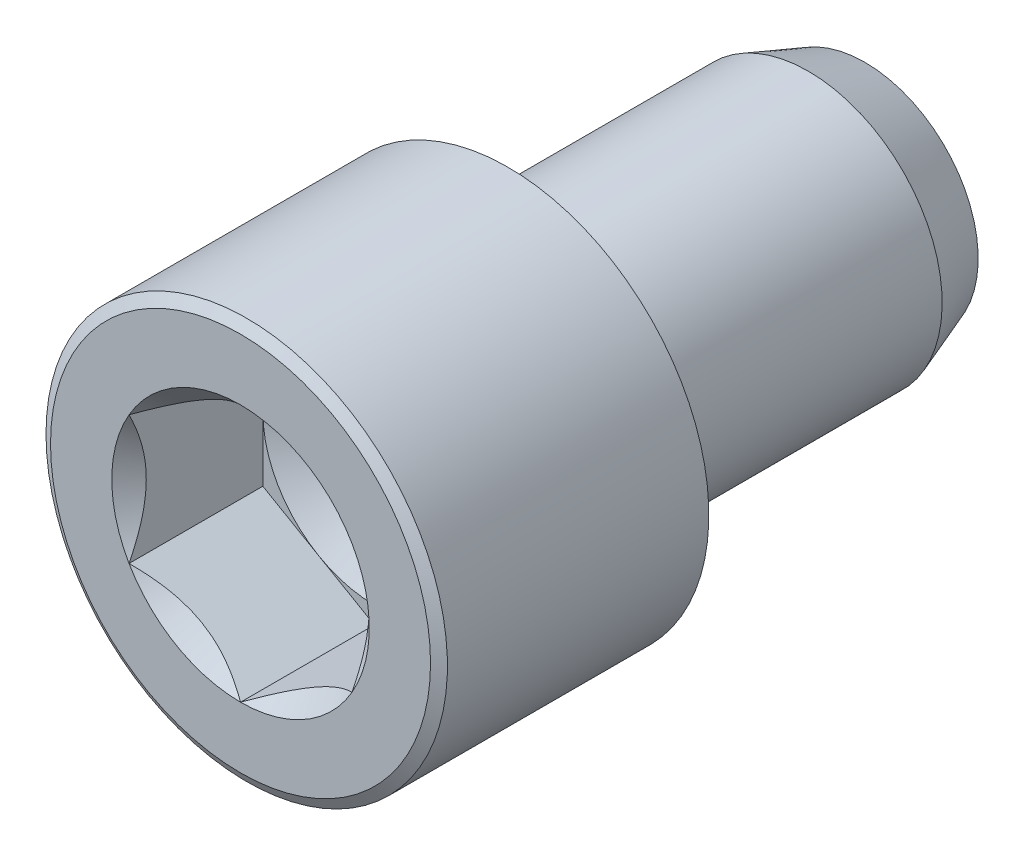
SolidWorks part; units mm, degrees
ref_plane "Front" through (0, 0, 0) normal (0, 0, 1) x (1, 0, 0)
ref_plane "Top" through (0, 0, 0) normal (0, 1, 0) x (1, 0, 0)
ref_plane "Right" through (0, 0, 0) normal (1, 0, 0) x (0, 0, -1)
sketch "Sketch1" plane through (0, 0, 0) normal (1, 0, 0) x (0, 0, -1)
  line L0 (0, 0) -> (-1.27, 0) construction
  line L1 (0, 0) -> (12.7, 0)
  line L2 (0, 0) -> (0, 4.7625)
  line L3 (0, 4.7625) -> (12.7, 4.7625)
  line L4 (12.7, 0) -> (12.7, 4.7625)
  line L5 (0, -4.7625) -> (12.7, -4.7625) construction
revolve "Revolve1" add sketch "Sketch1" angle 360 about L0
sketch "Sketch2" plane through (0, 0, 0) normal (1, 0, 0) x (0, 0, -1)
  line L0 (0, 4.7625) -> (0, -4.7625) construction
  line L1 (0, -4.7625) -> (1.5875, -4.7625) construction
  line L2 (1.5875, -4.7625) -> (0, 4.7625) construction
  line L3 (0, 4.7625) -> (0.1957, 4.7951) construction
  line L4 (0.1957, 4.7951) -> (1.5659, 5.0235)
  line L5 (1.5659, 5.0235) -> (1.2178, 4.0944)
  line L6 (1.2178, 4.0944) -> (0.8263, 4.0291)
  line L7 (0.8263, 4.0291) -> (0.1957, 4.7951)
  line L8 (1.0221, 4.0617) -> (0.8808, 4.9093) construction
  line L9 (0, -4.7625) -> (12.7, -4.7625) construction
  line L10 (0, 4.7625) -> (12.7, 4.7625) construction
  line L12 (0.9053, 4.7625) -> (2.4928, -4.7625) construction
  line L13 (0, -0.2832) -> (3.3981, 0.2832) construction
  line L15 (0, 0) -> (0, 4.7625) construction
  point P19 (1.699, 0)
revolve "Cut-Revolve1" [suppressed] cut sketch "Sketch2" angle 360 about L13
sketch "Sketch3" plane through (0, 0, 0) normal (1, 0, 0) x (0, 0, -1)
  line L0 (12.7, 4.0291) -> (10.685, 4.7625)
  line L1 (10.685, 4.7625) -> (12.7, 4.7625)
  line L2 (12.7, 4.7625) -> (12.7, 4.0291)
  line L3 (0, 4.7625) -> (12.7, 4.7625) construction
  line L4 (12.7, 0) -> (12.7, 4.7625) construction
  line L5 (10.685, 0) -> (0, 0) construction
  line L6 (10.685, 4.7625) -> (10.685, -4.7625) construction
  line L7 (0, -4.7625) -> (12.7, -4.7625) construction
  dimension "D1" = 20
  dimension "D2" = 9.525
revolve "Cut-Revolve2" cut sketch "Sketch3" angle 360 about L5
pattern_linear "LPattern1" [suppressed] count 8 spacing 1.5875 along (0, 0, 1)
pattern_linear "LPattern2" [suppressed] count 2 spacing 1.5875 along (0, 0, 1)
sketch "Sketch4" plane through (0, 0, 0) normal (0, 0, 1) x (1, 0, 0)
  circle A0 centre (0, 0) radius 7.1438
  dimension "Head Dia" = 14.2875
extrude "Extrude1" add sketch "Sketch4" along normal blind 9.525
chamfer "Chamfer1" distance 0.381 angle 30 1 edges at (7.1438, 0, 9.525)
sketch "Sketch6" plane through (0, 0, 9.525) normal (0, 0, 1) x (1, 0, 0)
  line L1 (0, -4.5827) -> (3.9687, -2.2914)
  line L2 (3.9687, -2.2914) -> (3.9687, 2.2914)
  line L3 (3.9687, 2.2914) -> (0, 4.5827)
  line L4 (0, 4.5827) -> (-3.9688, 2.2914)
  line L5 (-3.9688, 2.2914) -> (-3.9688, -2.2914)
  line L6 (-3.9688, -2.2914) -> (0, -4.5827)
  circle A0 centre (0, 0) radius 3.9688 construction
  dimension "Hex" = 7.9375
extrude "Cut-Extrude1" cut sketch "Sketch6" against normal blind 4.7625
sketch "Sketch7" plane through (0, 0, 9.525) normal (0, 0, 1) x (1, 0, 0)
  circle A0 centre (0, 0) radius 4.5827
extrude "Cut-Extrude4" cut sketch "Sketch7" against normal blind 4.7625 draft 45
sketch "Sketch8" plane through (0, 0, 4.7625) normal (0, 0, 1) x (1, 0, 0)
  circle A0 centre (0, 0) radius 3.9688 construction
  circle A1 centre (0, 0) radius 3.9688
extrude "Cut-Extrude5" cut sketch "Sketch8" against normal blind 1.5875 draft 60
equation "\"D1@Sketch1\"=\"Screw Length@Sketch1\"/10"
equation "\"D2@Sketch2\"=\"Thread Pitch@Sketch2\"/8"
equation "\"D3@Sketch2\"=\"Thread Pitch@Sketch2\"/4"
equation "\"D4@Sketch2\"=\"Thread Pitch@Sketch2\""
equation "\"D3@LPattern1\"=\"Thread Pitch@Sketch2\""
equation "\"D1@Chamfer1\"=\"Thread Dia@Sketch1\"/25"
equation "\"D1@Cut-Extrude1\"=\"Head Height@Extrude1\"/2"
equation "\"D1@Cut-Extrude4\"=\"D1@Cut-Extrude1\""
equation "\"D1@Cut-Extrude5\"=\"D1@Cut-Extrude1\"/3"
equation "\"D1@LPattern1\"=\"Screw Length@Sketch1\"/\"Thread Pitch@Sketch2\""
equation "\"D3@LPattern2\"=\"Thread Pitch@Sketch2\""
